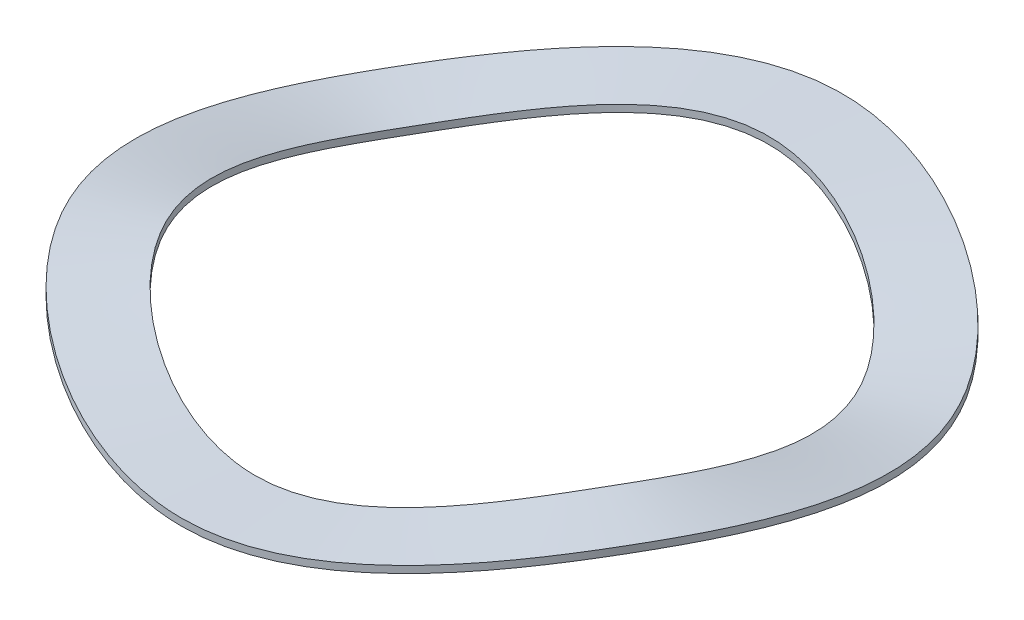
SolidWorks part; units mm, degrees
other "<217-2625-017 Rev1_9714K61>-<Imported1>"
ref_plane "Front Plane" through (0, 0, 0) normal (0, 0, 1) x (1, 0, 0)
ref_plane "Top Plane" through (0, 0, 0) normal (0, 1, 0) x (1, 0, 0)
ref_plane "Right Plane" through (0, 0, 0) normal (1, 0, 0) x (0, 0, -1)
mirrored part "217-2625-017 Rev1_9714K61_Mirrored"
